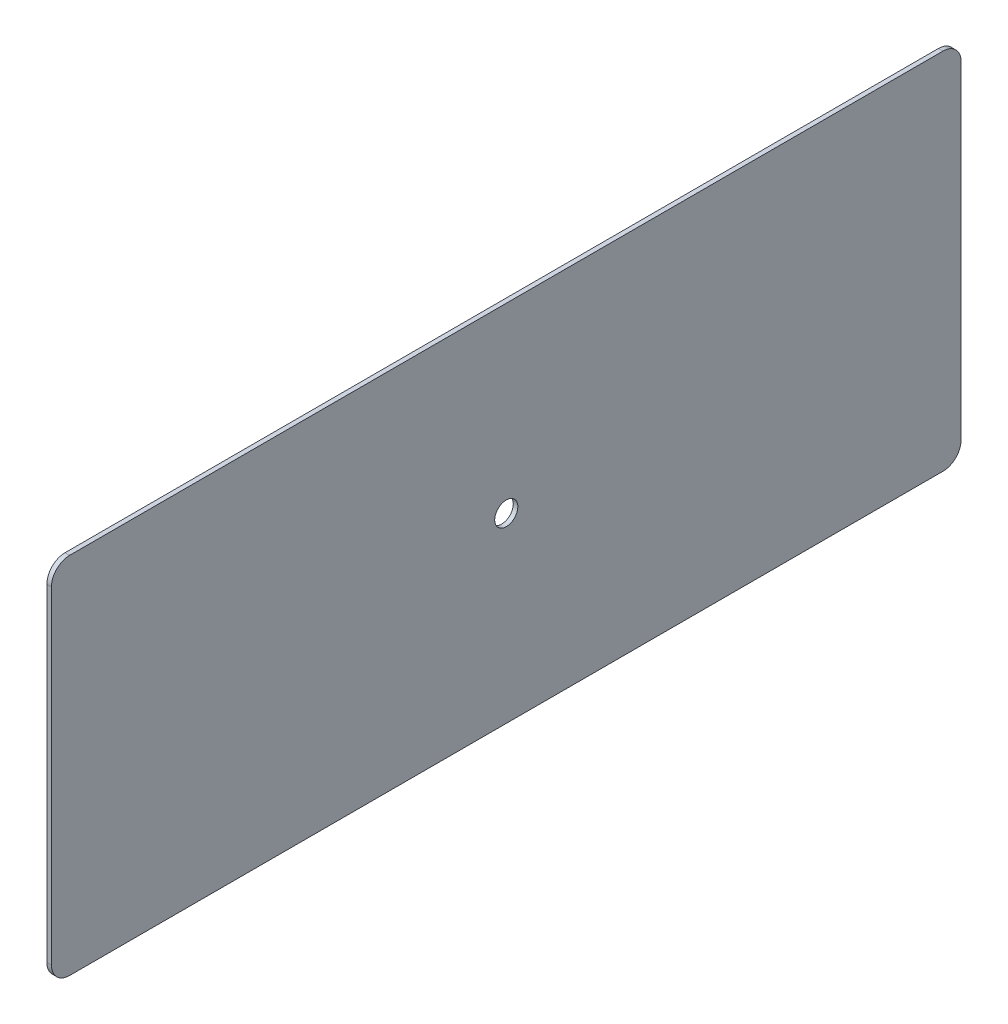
SolidWorks part; units mm, degrees
ref_plane "Front Plane" through (0, 0, 0) normal (0, 0, 1) x (1, 0, 0)
ref_plane "Top Plane" through (0, 0, 0) normal (0, 1, 0) x (1, 0, 0)
ref_plane "Right Plane" through (0, 0, 0) normal (1, 0, 0) x (0, 0, -1)
sketch "Sketch1" plane through (0, 0, 0) normal (1, 0, 0) x (0, 0, -1)
  line L5 (250, -100) -> (-250, -100)
  line L6 (250, -100) -> (250, 100)
  line L7 (250, 100) -> (-250, 100)
  line L8 (-250, -100) -> (-250, 100)
  line L9 (250, -100) -> (-250, 100) construction
  line L10 (250, 100) -> (-250, -100) construction
  circle A7 centre (0, 0) radius 6.35
  point P0 (0, 0)
  point P23 (0, 0)
  dimension "D3" = 12.7
  dimension "D1" = 500
  dimension "D2" = 200
extrude "Boss-Extrude1" add sketch "Sketch1" along normal blind 2.5
fillet "Fillet1" radius 10 4 edges at (1.25, -100, 250) (1.25, -100, -250) (1.25, 100, -250) (1.25, 100, 250)
